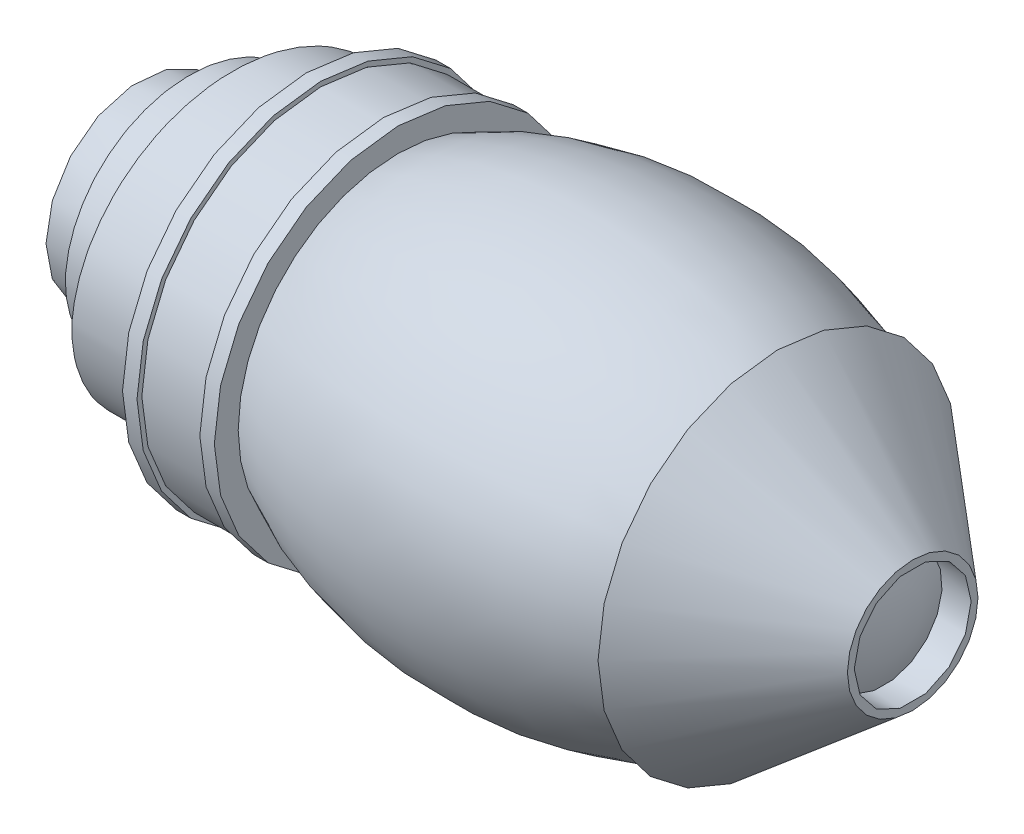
SolidWorks part; units mm, degrees
ref_plane "Front Plane" through (0, 0, 0) normal (0, 0, 1) x (1, 0, 0)
ref_plane "Top Plane" through (0, 0, 0) normal (0, 1, 0) x (1, 0, 0)
ref_plane "Right Plane" through (0, 0, 0) normal (1, 0, 0) x (0, 0, -1)
sketch "layout" plane through (0, 0, 0) normal (0, 0, 1) x (1, 0, 0)
  line L0 (0, 72.8645) -> (0, -75.9279)
  line L1 (-24.507, 51.8585) -> (-80.0854, 25.4872)
  line L2 (-24.507, -51.8585) -> (-80.0854, -25.4872)
  line L3 (-181.6143, 0) -> (272.2027, 0) construction
  line L4 (-80.0854, 25.4872) -> (-80.0854, -25.4872)
  line L5 (-24.507, 72.8645) -> (-24.507, -75.9279)
  line L6 (0, -25.4872) -> (72.6457, -78.5537)
  line L7 (0, 15.5357) -> (119.2298, -71.5597)
  line L8 (5.6891, 55.3595) -> (149.8845, -49.9727)
  line L9 (59.6149, 68.4883) -> (169.2448, -11.5945)
  line L10 (9.6277, -63.5) -> (129.0993, 55.3595)
  line L11 (55.5784, -75.9279) -> (160.4906, 28.4469)
  line L12 (0, -13.122) -> (82.0305, 68.4883)
  line L13 (0, 31.2902) -> (46.9503, 78)
  line L14 (129.0993, 51.8585) -> (129.0993, -51.8585)
  line L15 (129.0993, -51.8585) -> (147.042, -41.259)
  line L16 (147.042, -41.259) -> (147.042, 41.259)
  line L17 (147.042, 41.259) -> (129.0993, 51.8585)
  line L18 (-44.7559, 42.2506) -> (-27.1911, -50.5849)
  line L19 (-70.3187, 30.1213) -> (-57.7964, -36.0631)
  arc A0 (147.042, 34.7912) -> (164.9846, 55.3595) centre (127.6936, 69.7797) ccw
  arc A1 (147.042, 20.0085) -> (164.9846, 55.3595) centre (126.2417, 52.7948) ccw
  arc A2 (147.042, -20.0085) -> (164.9846, -55.3595) centre (126.2417, -52.7948) cw
  arc A3 (147.042, -34.7912) -> (164.9846, -55.3595) centre (127.6936, -69.7797) cw
  arc A4 (177.6757, 25.4872) -> (190.0383, 6.4422) centre (181.4271, 14.3874) cw
  arc A5 (190.0383, 6.4422) -> (212.5513, 0) centre (197.9301, -8.5375) cw
  arc A6 (190.0383, -6.4422) -> (212.5513, 0) centre (197.9301, 8.5375) ccw
  arc A7 (177.6757, -25.4872) -> (190.0383, -6.4422) centre (181.4271, -14.3874) ccw
  ellipse E0 centre (63.5, 0) end of major axis (-31.75, 0) minor radius 63.5
  spline S0 degree 3 poles (-19.2555, 63.5) (-17.4426, 65.895) (-13.4004, 71.2351) (-3.8421, 61.1456) (-5.6575, 46.6863) (-22.1801, 41.9027) (-21.6925, 25.1991) (-7.1944, 9.6527) (-2.088, 26.5071) (-6.5362, 32.0363) (-8.7525, 34.7912) knots 0 0 0 0 0.078911 0.175946 0.318094 0.467808 0.619611 0.780725 0.890747 1 1 1 1
  spline S1 degree 3 poles (-19.1604, 21.147) (-17.3475, 23.542) (-13.3053, 28.882) (-3.747, 18.7926) (-5.5623, 4.3333) (-22.085, -0.4503) (-21.5974, -17.154) (-7.0992, -32.7003) (-1.9929, -15.846) (-6.4411, -10.3167) (-8.6574, -7.5618) knots 0 0 0 0 0.078911 0.175946 0.318094 0.467808 0.619611 0.780725 0.890747 1 1 1 1
  spline S2 degree 3 poles (-19.1604, -17.8016) (-17.3475, -15.4066) (-13.3053, -10.0666) (-3.747, -20.156) (-5.5623, -34.6154) (-22.085, -39.399) (-21.5974, -56.1026) (-7.0992, -71.6489) (-1.9929, -54.7946) (-6.4411, -49.2654) (-8.6574, -46.5105) knots 0 0 0 0 0.078911 0.175946 0.318094 0.467808 0.619611 0.780725 0.890747 1 1 1 1
  spline S3 degree 3 poles (164.9846, 34.7912) (163.4358, 35.2072) (158.2445, 36.6018) (159.3414, 24.8306) (166.1705, 19.5024) (174.0785, 8.5709) (183.4666, 19.6788) (179.3793, 23.7784) (177.6757, 25.4872) knots 0 0 0 0 0.084111 0.281928 0.425819 0.683243 0.867972 1 1 1 1
  spline S4 degree 3 poles (164.9846, -34.7912) (163.4358, -35.2072) (158.2445, -36.6018) (159.3414, -24.8306) (166.1705, -19.5024) (174.0785, -8.5709) (183.4666, -19.6788) (179.3793, -23.7784) (177.6757, -25.4872) knots 0 0 0 0 0.084111 0.281928 0.425819 0.683243 0.867972 1 1 1 1
  dimension "D1" = 127
  dimension "D2" = 63.5
  dimension "D3" = 190.5
sketch "Sketch2" plane through (0, 0, 0) normal (0, 0, 1) x (1, 0, 0)
  line L0 (-100.8728, 0) -> (272.2027, 0) construction
  line L1 (-181.6143, 0) -> (272.2027, 0) construction
  line L2 (-31.75, 0) -> (158.75, 0)
  ellipse E0 centre (63.5, 0) end of major axis (-31.75, 0) minor radius 63.5 construction
  ellipse E1 centre (63.5, 0) end of major axis (-31.75, 0) minor radius 63.5 (158.75, 0) -> (-31.75, 0) ccw
revolve "Revolve1" add sketch "Sketch2" angle 360 about L0
sketch "Sketch3" plane through (0, 0, 0) normal (0, 0, 1) x (1, 0, 0)
  line L0 (3.993, 0) -> (3.993, 57)
  line L1 (-24.507, 0) -> (3.993, 0)
  line L2 (3.993, 57) -> (-0.507, 57)
  line L3 (-0.507, 57) -> (-0.507, 55.5)
  line L4 (-0.507, 55.5) -> (-20.007, 55.5)
  line L5 (-20.007, 55.5) -> (-20.007, 57)
  line L6 (-20.007, 57) -> (-24.507, 57)
  line L7 (-24.507, 72.8645) -> (-24.507, -75.9279) construction
  line L8 (-24.507, 57) -> (-24.507, 0)
  line L10 (-41.403, 0) -> (182.3861, 0) construction
  line L11 (-181.6143, 0) -> (272.2027, 0) construction
  line L14 (118.939, 50.6568) -> (121.7488, 55.6432)
  line L15 (121.7488, 55.6432) -> (163.7892, 20.2678)
  line L16 (163.7892, 20.2678) -> (163.7892, 18.1541)
  line L17 (163.7892, 18.1541) -> (118.939, 18.1541)
  line L18 (118.939, 18.1541) -> (118.939, 50.6568)
  dimension "D1" = 4.5
  dimension "D2" = 1.5
  dimension "D3" = 114
  dimension "D4" = 28.5
  dimension "D5" = 36.3082
  dimension "D6" = 2.1137
  dimension "D7" = 5.7235
  dimension "D8" = 111.2864
  dimension "D9" = 159.7962
  dimension "D10" = 44.8502
  dimension "D11" = 101.3136
revolve "Revolve2" add sketch "Sketch3" angle 360 about L10
sketch "Sketch4" plane through (-24.507, 0, 0) normal (-1, 0, 0) x (0, 0, 1)
  circle A0 centre (0, 0) radius 54
  dimension "D1" = 108
curve "Helix/Spiral1" parameters "D10001"=25.25, "D30001"=95, "D40001"=20, "D10002"=12.5, "D30002"=74, "D40002"=5, "D10003"=3.25, "D30003"=58.5, "D40003"=1.5, "D50000"=30.5
sketch "Sketch5" plane through (0, 0, 0) normal (1, 0, 0) x (0, 0, -1)
  spline S0 degree 3 number of poles 126 (-54, 0) -> (-29.25, 0) construction
  spline S1 degree 3 number of poles 126 (-54, 0) -> (-29.25, 0)
surface "Surface-Loft1"
other "Ruled Surface1" parameters "D1"=15, "D2"=3
surface "Surface-Plane1"
surface "Surface-Trim1"
sketch "Sketch6" plane through (0, 0, 0) normal (1, 0, 0) x (0, 0, -1)
  circle A0 centre (0, 0) radius 29.25
surface "Surface-Extrude1" sketch "Sketch6" parameters "D1"=76
surface "Surface-Trim3"
surface "Surface-Plane2"
curve "Curve1"
surface "Surface-Plane3"
surface "Surface-Loft2"
surface "Surface-Knit2"
combine bodies "Combine1" operation type add bodies to combine 103 303
